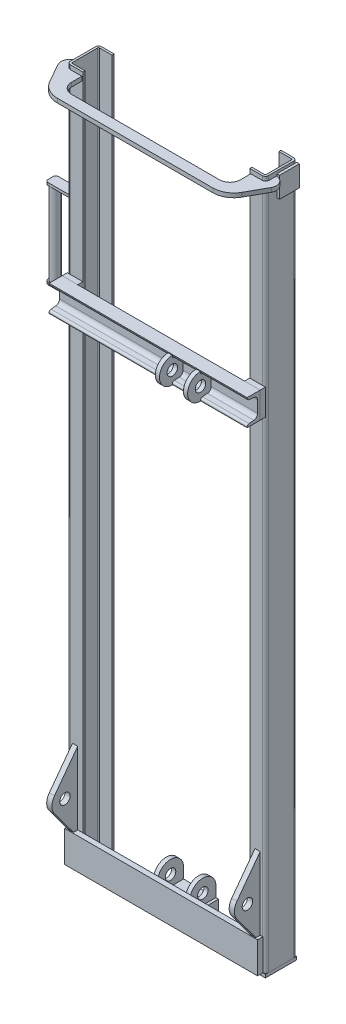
SolidWorks part; units mm, degrees
ref_plane "Plan de face" through (0, 0, 0) normal (0, 0, 1) x (1, 0, 0)
ref_plane "Plan de dessus" through (0, 0, 0) normal (0, 1, 0) x (1, 0, 0)
ref_plane "Plan de droite" through (0, 0, 0) normal (1, 0, 0) x (0, 0, -1)
sketch "Esquisse1" plane through (0, 0, 0) normal (0, 0, 1) x (1, 0, 0)
  line L0 (-190, 0) -> (190, 0)
  dimension "D1" = 380
other "Elément mécano-soudé1"
ref_plane "Plan1" through (-190, 0, 0) normal (1, 0, 0) x (0, 0, -1)
sketch "Esquisse11" plane through (-190, 3, 0) normal (1, 0, 0) x (0, 0, -1)
  line L0 (0, 3) -> (0, -3) construction
  line L1 (-30, 3) -> (30, 3)
  line L2 (-30, 3) -> (-30, -3)
  line L3 (-30, -3) -> (30, -3)
  line L4 (30, 3) -> (30, -3)
  line L5 (-30, 0) -> (30, 0) construction
  point P9 (0, 0)
  dimension "D1" = 60
  dimension "D2" = 6
sketch "Esquisse13" plane through (0, 0, 30) normal (0, 0, 1) x (1, 0, 0)
  line L0 (-185, 6) -> (185, 6)
  line L1 (190, 6) -> (-190, 6) construction
  line L2 (0, 0) -> (0, 6) construction
  line L3 (-190, 0) -> (190, 0) construction
  dimension "D1" = 370
other "Elément mécano-soudé2"
ref_plane "Plan3" through (-185, 6, 30) normal (1, 0, 0) x (0, 0, -1)
sketch "Esquisse12" plane through (-185, 36, 35) normal (1, 0, 0) x (0, -1, 0)
  line L0 (0, 5) -> (0, -5) construction
  line L1 (-30, 5) -> (30, 5)
  line L2 (-30, 5) -> (-30, -5)
  line L3 (-30, -5) -> (30, -5)
  line L4 (30, 5) -> (30, -5)
  line L5 (-30, 0) -> (30, 0) construction
  point P8 (0, 0)
  dimension "D1" = 60
  dimension "D2" = 10
sketch "Esquisse14" plane through (0, 0, 30) normal (0, 0, -1) x (-1, 0, 0)
  line L0 (-190, 6) -> (-190, 1330)
  dimension "D1" = 1324
other "Elément mécano-soudé3"
ref_plane "Plan5" through (190, 6, 30) normal (0, 1, 0) x (-1, 0, 0)
sketch "Esquisse16" plane through (190, 6, 0) normal (0, 1, 0) x (-1, 0, 0)
  line L0 (0, 0) -> (54.3278, 0) construction
  line L1 (0, -24) -> (0, 24)
  line L2 (6, 30) -> (30, 30)
  line L3 (30, 30) -> (30, 26)
  line L4 (30, 26) -> (6, 26)
  line L5 (4, 24) -> (4, -24)
  line L6 (30, -26) -> (6, -26)
  line L7 (30, -30) -> (30, -26)
  line L8 (6, -30) -> (30, -30)
  arc A0 (6, 30) -> (0, 24) centre (6, 24) ccw
  arc A1 (6, 26) -> (4, 24) centre (6, 24) ccw
  arc A2 (6, -26) -> (4, -24) centre (6, -24) cw
  arc A3 (6, -30) -> (0, -24) centre (6, -24) cw
  point P17 (4, 0)
  point P19 (0, 30)
  point P20 (0, -30)
  point P21 (0, 0)
  dimension "D5" = 6
  dimension "D1" = 4
  dimension "D3" = 60
  dimension "D4" = 30
mirror "Symétrie1" about plane through (0, 0, 0) normal (1, 0, 0)
sketch "Esquisse17" plane through (0, 6, 0) normal (0, 1, 0) x (-1, 0, 0)
  line L0 (-40.017, 0) -> (39.983, 0)
  point P3 (-0.017, 0)
  dimension "D1" = 80
other "Elément mécano-soudé4"
ref_plane "Plan6" through (40.017, 6, 0) normal (-1, 0, 0) x (0, 0, 1)
sketch "Esquisse18" plane through (40.017, 16, 0) normal (-1, 0, 0) x (0, 0, 1)
  line L0 (0, 10) -> (0, -10) construction
  line L1 (-30, 10) -> (30, 10)
  line L2 (-30, 10) -> (-30, -10)
  line L3 (-30, -10) -> (30, -10)
  line L4 (30, 10) -> (30, -10)
  line L5 (-30, 0) -> (30, 0) construction
  point P8 (0, 0)
  dimension "D1" = 60
  dimension "D2" = 20
inserted part "laser chape bas vérin de levée"
move or copy body "Corps-Déplacer/Copier2" placed by mates yes
other "Distance1" parameters "D1"=27
other "<laser chape bas vérin de levée>-<Extrusion1>"
inserted part "laser chape bas vérin de levée1"
move or copy body "Corps-Déplacer/Copier4" placed by mates yes
other "Distance2" parameters "D1"=27
other "<laser chape bas vérin de levée>-<Extrusion1>"
inserted part "laser haut de coulisse externe"
move or copy body "Corps-Déplacer/Copier6" placed by mates yes
other "Distance3" parameters "D1"=8
other "Distance4" parameters "D1"=0.5
other "<laser haut de coulisse externe>-<Extrusion1>"
sketch "Esquisse19" plane through (-190, 0, 0) normal (-1, 0, 0) x (0, 0, 1)
  line L0 (-30, 1325) -> (8, 1325)
  line L2 (-30, 1330) -> (-30, 6) construction
  line L3 (24, 1330) -> (-24, 1330) construction
  dimension "D1" = 38
  dimension "D2" = 5
other "Elément mécano-soudé5"
ref_plane "Plan7" through (-190, 1325, -30) normal (0, 0, 1) x (1, 0, 0)
sketch "Esquisse110" plane through (-195, 1325, -30) normal (0, 0, 1) x (0, -1, 0)
  line L0 (20, 5) -> (20, 0) construction
  line L1 (0, 0) -> (40, 0)
  line L2 (0, 0) -> (0, 5)
  line L3 (0, 5) -> (40, 5)
  line L4 (40, 0) -> (40, 5)
  line L5 (40, 2.5) -> (0, 2.5) construction
  point P9 (0, 0)
  dimension "D1" = 40
  dimension "D2" = 5
inserted part "laser chape du mât sur le mât"
move or copy body "Corps-Déplacer/Copier8" placed by mates yes
other "Distance5" parameters "D1"=170
other "<laser chape du mât sur le mât>-<Extrusion1>"
mirror "Symétrie2" about plane through (0, 0, 0) normal (1, 0, 0)
sketch "Esquisse111" plane through (0, 0, 30) normal (0, 0, 1) x (1, 0, 0)
  line L0 (-190, 981.6) -> (-190, 931.6)
  line L4 (-190, 1330) -> (-190, 6) construction
  line L5 (160, 981.6) -> (160, 931.6)
  line L6 (160, 1330) -> (160, 6) construction
  line L7 (-160, 1330) -> (-184, 1330) construction
  dimension "D1" = 50
  dimension "D2" = 348.4
other "Elément mécano-soudé6"
ref_plane "Plan8" through (-190, 981.6, 30) normal (0, -1, 0) x (1, 0, 0)
sketch "Esquisse112" plane through (-175, 981.6, 35) normal (0, -1, 0) x (1, 0, 0)
  line L0 (0, 5) -> (0, -5) construction
  line L1 (-15, 5) -> (15, 5)
  line L2 (-15, 5) -> (-15, -5)
  line L3 (-15, -5) -> (15, -5)
  line L4 (15, 5) -> (15, -5)
  line L5 (-15, 0) -> (15, 0) construction
  point P8 (0, 0)
  dimension "D1" = 30
  dimension "D2" = 10
sketch "Esquisse113" plane through (0, 0, 40) normal (0, 0, 1) x (1, 0, 0)
  line L0 (-190, 981.6) -> (190, 981.6)
other "Elément mécano-soudé7"
ref_plane "Plan9" through (-190, 981.6, 40) normal (1, 0, 0) x (0, 0, -1)
sketch "Sketch11" plane through (-190, 981.6, 40) normal (1, 0, 0) x (0, 0, 1)
  line L0 (25, 50) -> (0, 50)
  line L1 (25, 0) -> (0, 0)
  line L2 (0, 50) -> (0, 0)
  line L3 (13, 36) -> (13, 14) construction
  line L4 (0, 25) -> (13, 25) construction
  line L6 (25, 50) -> (25, 48.9069)
  line L7 (25, 0) -> (25, 1.0931)
  line L12 (5, 36) -> (5, 14)
  line L17 (12.1638, 43.9562) -> (21.4181, 44.9288)
  line L18 (12.1638, 6.0438) -> (21.4181, 5.0712)
  arc A0 (21.4181, 44.9288) -> (25, 48.9069) centre (21, 48.9069) ccw
  arc A1 (21.4181, 5.0712) -> (25, 1.0931) centre (21, 1.0931) cw
  arc A9 (5, 14) -> (12.1638, 6.0438) centre (13, 14) ccw
  arc A10 (5, 36) -> (12.1638, 43.9562) centre (13, 36) cw
  point P8 (0, 25)
  point P9 (5, 25)
  point P10 (12.5, 50)
  point P11 (12.5, 0)
  point P12 (25, 4.6947)
  point P13 (25, 45.3053)
  point P16 (0, 0)
  dimension "D4" = 4
  dimension "RI" = 8
  dimension "D2" = 6
  dimension "Depth" = 50
  dimension "BF" = 25
  dimension "TW" = 5
  dimension "d1" = 22
inserted part "laser chape de tilt sur mât"
move or copy body "Corps-Déplacer/Copier10" placed by mates yes
other "Distance6" parameters "D1"=89
other "<laser chape de tilt sur mât>-<Extrusion1>"
inserted part "laser chape de tilt sur mât1"
move or copy body "Corps-Déplacer/Copier12" placed by mates yes
other "Distance7" parameters "D1"=46
other "<laser chape de tilt sur mât>-<Extrusion1>"
ref_plane "Plan10" through (0, 0, 22) normal (0, 0, 1) x (1, 0, 0)
sketch "Esquisse116" plane through (0, 0, 22) normal (0, 0, 1) x (1, 0, 0)
  line L0 (-190, 1105) -> (-240, 1105)
  line L1 (-190, 1330) -> (-190, 6) construction
  line L2 (-190, 940) -> (-240, 940)
  line L3 (-160, 1330) -> (-184, 1330) construction
  dimension "D1" = 50
  dimension "D2" = 165
  dimension "D3" = 225
other "Elément mécano-soudé8"
ref_plane "Plan11" through (-190, 1105, 22) normal (-1, 0, 0) x (0, 0, 1)
sketch "Esquisse114" plane through (-190, 1102.5, 12) normal (-1, 0, 0) x (0, 0, 1)
  line L0 (0, 2.5) -> (0, -2.5) construction
  line L1 (-10, 2.5) -> (10, 2.5)
  line L2 (-10, 2.5) -> (-10, -2.5)
  line L3 (-10, -2.5) -> (10, -2.5)
  line L4 (10, 2.5) -> (10, -2.5)
  line L5 (-10, 0) -> (10, 0) construction
  point P8 (0, 0)
  dimension "D1" = 5
  dimension "D2" = 20
fillet "Congé1" radius 5 2 edges at (-240, 1102.5, 2) (-240, 1102.5, 22)
fillet "Congé2" radius 5 2 edges at (-240, 937.5, 2) (-240, 937.5, 22)
ref_plane "Plan12" through (0, 0, 12) normal (0, 0, 1) x (1, 0, 0)
sketch "Esquisse117" plane through (0, 0, 12) normal (0, 0, 1) x (1, 0, 0)
  line L0 (-240, 1100) -> (-240, 940)
  line L1 (-235, 1100) -> (-190, 1100) construction
  line L2 (-190, 940) -> (-240, 940) construction
other "Elément mécano-soudé9"
ref_plane "Plan13" through (-240, 1100, 12) normal (0, -1, 0) x (1, 0, 0)
sketch "Esquisse115" plane through (-231.5, 1100, 12) normal (0, -1, 0) x (1, 0, 0)
  line L0 (-8.5, 0) -> (8.5, 0) construction
  line L1 (0, 8.5) -> (0, -8.5) construction
  circle A0 centre (0, 0) radius 6
  circle A1 centre (0, 0) radius 8.5
  point P8 (0, 0)
  dimension "D1" = 17
  dimension "D2" = 2.5
